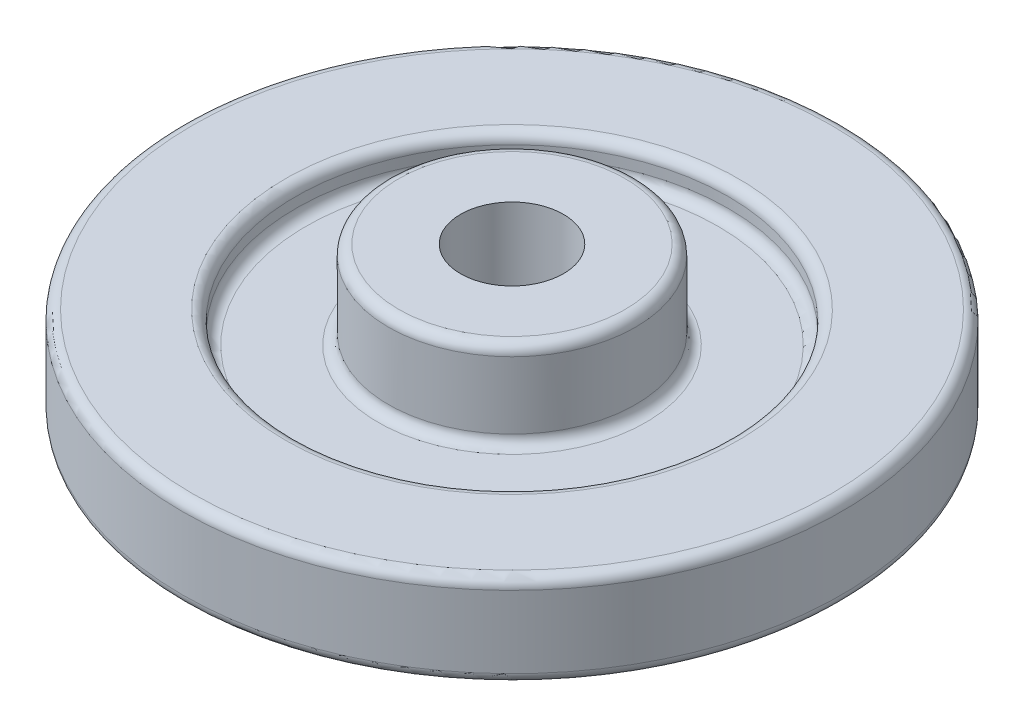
SolidWorks part; units mm, degrees
ref_plane "front" through (0, 0, 0) normal (0, 0, 1) x (1, 0, 0)
ref_plane "top" through (0, 0, 0) normal (0, 1, 0) x (1, 0, 0)
ref_plane "right" through (0, 0, 0) normal (1, 0, 0) x (0, 0, -1)
sketch "Sketch1" plane through (0, 0, 0) normal (0, 0, 1) x (1, 0, 0)
  line L0 (0, 0) -> (0, 73.4321) construction
  line L1 (0, 0) -> (101.6, 0)
  line L2 (101.6, 0) -> (101.6, 28.575)
  line L3 (101.6, 28.575) -> (38.1, 28.575)
  line L4 (38.1, 28.575) -> (38.1, 46.0502)
  line L5 (38.1, 46.0502) -> (0, 46.0502)
  line L6 (0, 46.0502) -> (0, 0)
  dimension "hub_hgt" = 46.0502
  dimension "rim_hgt" = 28.575
  dimension "D3" = 76.2
  dimension "D4" = 203.2
revolve "wheel" add sketch "Sketch1" angle 360 about L0
sketch "Sketch2" plane through (0, 46.0502, 0) normal (0, 1, 0) x (-1, 0, 0)
  circle A0 centre (0, 0) radius 15.875
  dimension "bore_diam" = 31.75
extrude "center_h" cut sketch "Sketch2" against normal through all
sketch "Sketch3" plane through (0, 0, 0) normal (0, 0, 1) x (1, 0, 0)
  line L0 (0, 0) -> (0, 57.8488) construction
  line L1 (0, 0) -> (0, 46.0502) construction
  line L2 (38.1, 28.575) -> (38.1, 46.0502) construction
  line L3 (38.1, 28.575) -> (38.1, 19.05)
  line L4 (38.1, 19.05) -> (66.675, 19.05)
  line L5 (66.675, 19.05) -> (66.675, 28.575)
  line L6 (66.675, 28.575) -> (38.1, 28.575)
  line L7 (101.6, 28.575) -> (-101.6, 28.575) construction
  dimension "upper_cut_depth" = 9.525
  dimension "D3" = 133.35
revolve "upper_cut" cut sketch "Sketch3" angle 360 about L0
sketch "Sketch4" plane through (0, 0, 0) normal (0, 0, 1) x (1, 0, 0)
  line L1 (38.1, 9.525) -> (38.1, 0)
  line L2 (38.1, 0) -> (61.9125, 0)
  line L3 (61.9125, 0) -> (61.9125, 9.525)
  line L4 (61.9125, 9.525) -> (38.1, 9.525)
  line L5 (-101.6, 0) -> (101.6, 0) construction
  line L7 (0, 0) -> (0, 56.4648) construction
  line L8 (0, 0) -> (0, 46.0502) construction
  line L19 (38.1, 28.575) -> (38.1, 46.0502) construction
  dimension "lower_cut_depth" = 9.525
  dimension "D3" = 123.825
revolve "lower_cut" cut sketch "Sketch4" angle 360 about L7
fillet "R.125" radius 3.175 8 edges at (0, 19.05, -38.1) (0, 19.05, -66.675) (0, 28.575, -66.675) (0, 0, -61.9125) (0, 9.525, -61.9125) (0, 46.0502, -38.1) (0, 28.575, -101.6) (0, 0, -101.6)
sketch "Sketch5" plane through (0, 46.0502, 0) normal (0, 1, 0) x (-1, 0, 0)
  line L1 (0, 0) -> (0, 101.6)
  line L2 (0, 101.6) -> (-101.6, 101.6)
  line L3 (-101.6, 101.6) -> (-101.6, 0)
  line L4 (-101.6, 0) -> (0, 0)
  circle A0 centre (0, 0) radius 101.6 construction
extrude "cutaway" cut sketch "Sketch5" against normal through all
